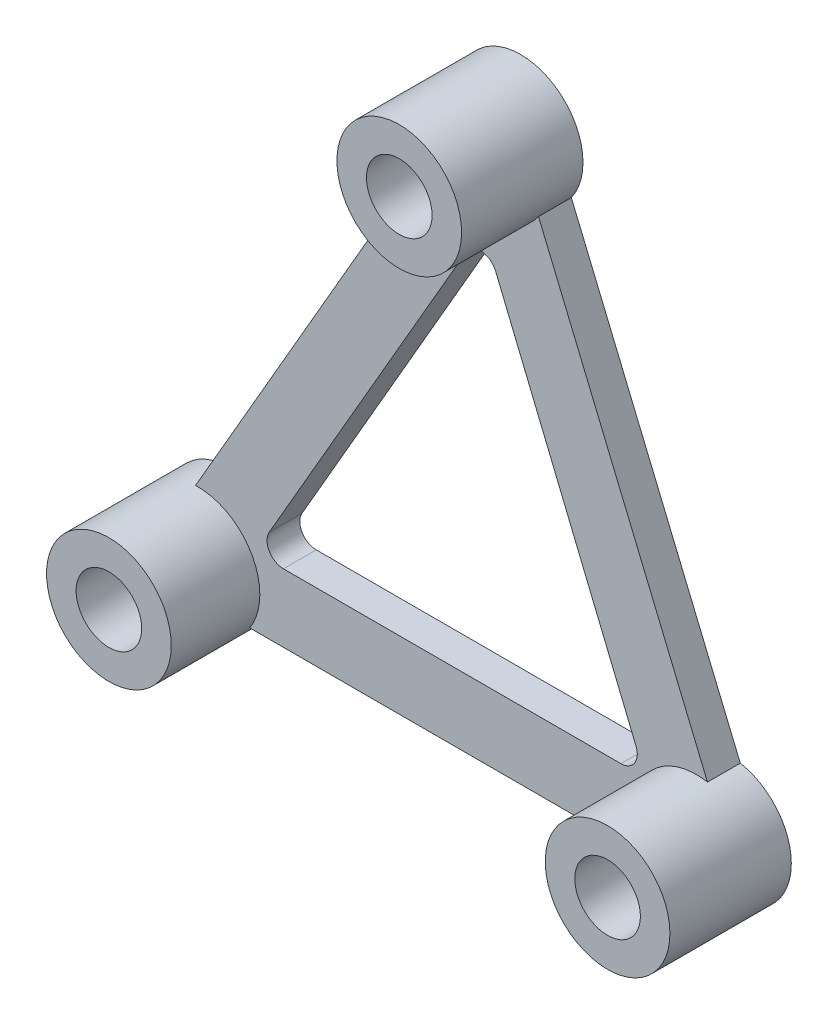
SolidWorks part; units mm, degrees
ref_plane "Plan de face" through (0, 0, 0) normal (0, 0, 1) x (1, 0, 0)
ref_plane "Plan de dessus" through (0, 0, 0) normal (0, 1, 0) x (1, 0, 0)
ref_plane "Plan de droite" through (0, 0, 0) normal (1, 0, 0) x (0, 0, -1)
sketch "Esquisse1" plane through (0, 0, 0) normal (0, 0, 1) x (1, 0, 0)
  line L1 (0, 0) -> (30.4, 0) construction
  line L3 (0, 0) -> (17.7, 30.6573) construction
  line L4 (17.7, 30.6573) -> (0, 0) construction
  line L6 (15.9679, 31.6573) -> (-2.0062, 0.5252)
  line L7 (30.4, 0) -> (0, 0) construction
  line L8 (30.4, -2.0738) -> (0, -2.0738)
  line L10 (30.4, 0) -> (17.7, 30.6573) construction
  line L11 (27.3037, 2.0738) -> (17.3987, 26.1353)
  line L12 (32.3141, 0.7979) -> (19.546, 31.4268)
  line L13 (17.3987, 26.1353) -> (3.5067, 2.0738)
  line L14 (27.3037, 2.0738) -> (3.5067, 2.0738)
  arc A2 (19.546, 31.4268) -> (15.9679, 31.6573) centre (17.7, 30.6573) ccw
  arc A3 (-2.0062, 0.5252) -> (0, -2.0738) centre (0, 0) ccw
  arc A6 (30.4, -2.0738) -> (32.3141, 0.7979) centre (30.4, 0) ccw
  point P1 (17.6157, 32.6555)
  point P9 (15, 0)
  point P15 (24.7227, 9.7227)
  dimension "D1" = 4
  dimension "D3" = 30.4
  dimension "D4" = 35.4
  dimension "D5" = 60
extrude "Boss.-Extru.1" add sketch "Esquisse1" along normal blind 2
fillet "Congé1" radius 1 3 edges at (27.3037, 2.0738, 1) (3.5067, 2.0738, 1) (17.3987, 26.1353, 1)
sketch "Esquisse2" plane through (0, 0, 2) normal (0, 0, 1) x (1, 0, 0)
  circle A0 centre (0, 0) radius 3.8
  circle A1 centre (30.4, 0) radius 2
  circle A2 centre (0, 0) radius 2
  circle A3 centre (30.4, 0) radius 3.8
  circle A4 centre (17.7, 30.6573) radius 3.8
  circle A5 centre (17.7, 30.6573) radius 2
  dimension "D1" = 7.6
  dimension "D2" = 4
extrude "Boss.-Extru.2" add sketch "Esquisse2" along normal blind 5.4 and the other way blind 2
